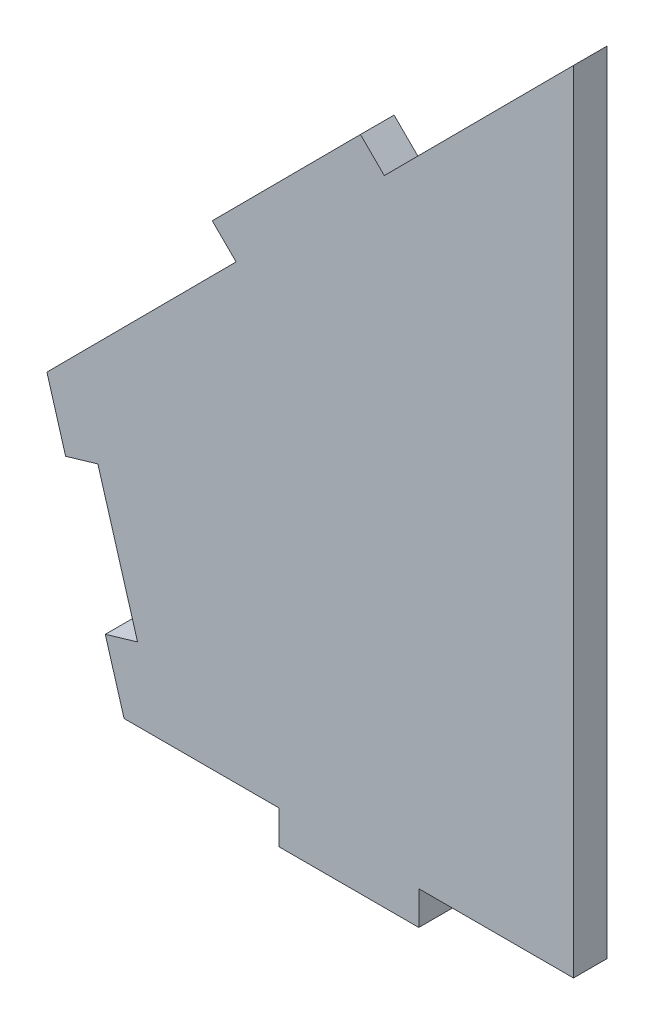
SolidWorks part; units mm, degrees
ref_plane "Front Plane" through (0, 0, 0) normal (0, 0, 1) x (1, 0, 0)
ref_plane "Top Plane" through (0, 0, 0) normal (0, 1, 0) x (1, 0, 0)
ref_plane "Right Plane" through (0, 0, 0) normal (1, 0, 0) x (0, 0, -1)
sketch "Sketch1" plane through (0, 0, 0) normal (0, 0, 1) x (1, 0, 0)
  line L0 (-16.8229, 31.0188) -> (-25.4011, 22.4034)
  line L1 (0, 30.3874) -> (0, 19.4332)
  line L2 (0, 19.4332) -> (-1.524, 19.4332)
  line L3 (-1.524, 19.4332) -> (-1.524, 46.3839)
  line L4 (-10.1023, 37.7685) -> (-11.1822, 38.8438)
  line L5 (-16.8229, 31.0188) -> (-17.9028, 32.0941)
  line L6 (-1.524, 46.3839) -> (-10.1023, 37.7685)
  line L7 (-25.4011, 22.4034) -> (-24.5505, 19.522)
  line L8 (-22.7526, 13.4318) -> (-21.902, 10.5505)
  line L9 (-11.1822, 38.8438) -> (-17.9028, 32.0941)
  line L10 (-22.7526, 13.4318) -> (-21.291, 13.8633)
  line L11 (-21.902, 10.5505) -> (-14.888, 10.5505)
  line L12 (-24.5505, 19.522) -> (-23.0889, 19.9535)
  line L14 (-1.524, -4.5575) -> (-1.524, 54.3782) construction
  line L15 (18.3147, 24.1558) -> (19.673, 24.5832)
  line L16 (18.3147, 24.1558) -> (19.673, 24.5832)
  line L17 (17.3998, 27.0633) -> (18.7581, 27.4907)
  line L18 (17.3998, 27.0633) -> (18.7581, 27.4907)
  line L19 (-1.524, 10.5505) -> (-1.524, 19.4332)
  line L20 (-8.538, 10.5505) -> (-1.524, 10.5505)
  line L21 (-21.291, 13.8633) -> (-23.0889, 19.9535)
  line L22 (-14.888, 10.5505) -> (-14.888, 9.0265)
  line L23 (-8.538, 10.5505) -> (-8.538, 9.0265)
  line L25 (-14.888, 9.0265) -> (-8.538, 9.0265)
  line L35 (0, 30.3874) -> (-1.524, 19.4332)
  dimension "D1" = 1.524
  dimension "D2" = 1.524
extrude "Boss-Extrude1" add sketch "Sketch1" along normal blind 1.524 contours L35 L1 L2 L3 L6 L4 L9 L5 L0 L7 L12 L21 L10 L8 L11 L22 L25 L23 L20 L19
